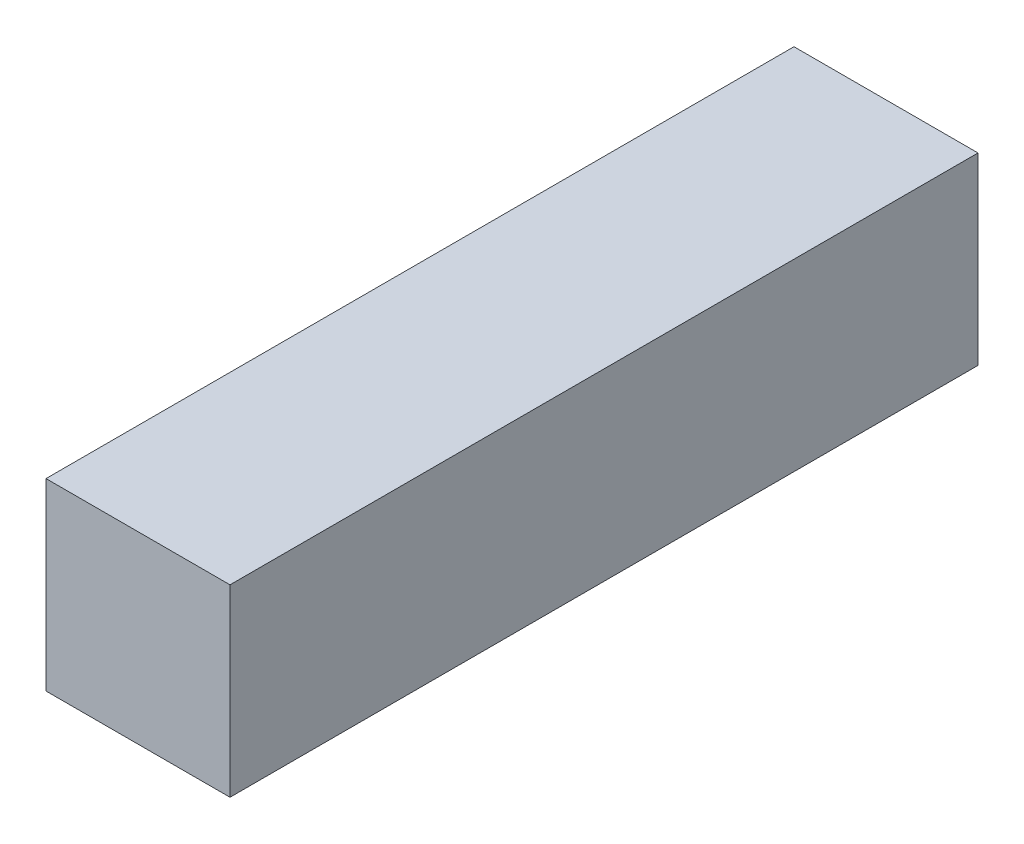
SolidWorks part; units mm, degrees
ref_plane "Piano frontale" through (0, 0, 0) normal (0, 0, 1) x (1, 0, 0)
ref_plane "Piano superiore" through (0, 0, 0) normal (0, 1, 0) x (1, 0, 0)
ref_plane "Piano destro" through (0, 0, 0) normal (1, 0, 0) x (0, 0, -1)
sketch "Sketch1" plane through (0, 0, 0) normal (1, 0, 0) x (0, 0, -1)
  line L1 (-101.8793, -0.429) -> (-93.7493, -0.429)
  line L2 (-101.8793, -0.429) -> (-101.8793, 1.571)
  line L3 (-101.8793, 1.571) -> (-93.7493, 1.571)
  line L4 (-93.7493, -0.429) -> (-93.7493, 1.571)
  dimension "D1" = 8.13
  dimension "D2" = 2
extrude "Boss-Extrude1" add sketch "Sketch1" along normal blind 2
